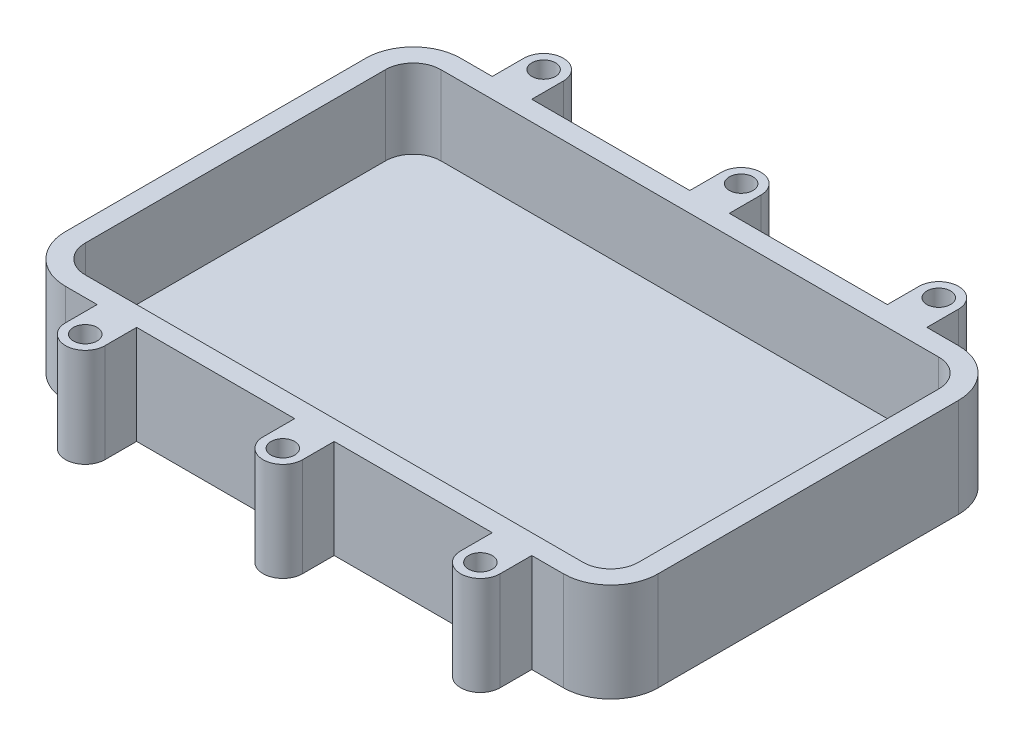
SolidWorks part; units mm, degrees
ref_plane "Front Plane" through (0, 0, 0) normal (0, 0, 1) x (1, 0, 0)
ref_plane "Top Plane" through (0, 0, 0) normal (0, 1, 0) x (1, 0, 0)
ref_plane "Right Plane" through (0, 0, 0) normal (1, 0, 0) x (0, 0, -1)
sketch "Sketch1" plane through (0, 0, 0) normal (0, 1, 0) x (1, 0, 0)
  line L0 (0, 0) -> (-75, 0) construction
  line L1 (63, 50) -> (-63, 50)
  line L2 (63, -50) -> (-63, -50)
  line L3 (-75, 38) -> (-75, -38)
  line L4 (0, 0) -> (0, 50) construction
  line L5 (75, 38) -> (75, -38)
  arc A0 (-75, 38) -> (-63, 50) centre (-63, 38) cw
  arc A1 (63, 50) -> (75, 38) centre (63, 38) cw
  arc A2 (-63, -50) -> (-75, -38) centre (-63, -38) cw
  arc A3 (75, -38) -> (63, -50) centre (63, -38) cw
  point P7 (-75, 0)
  point P10 (0, -50)
  point P12 (-75, 50)
  point P15 (75, 50)
  point P18 (-75, -50)
  point P21 (75, -50)
  dimension "D3" = 12
  dimension "D1" = 100
  dimension "D2" = 150
extrude "Extrude1" add sketch "Sketch1" along normal blind 25
shell "Shell1" thickness 5
sketch "Sketch2" plane through (0, 25, 0) normal (0, 1, 0) x (-1, 0, 0)
  line L0 (0, -50) -> (0, -58) construction
  line L1 (-63, -50) -> (63, -50) construction
  line L2 (-5, -50) -> (-5, -58)
  line L3 (5, -50) -> (5, -58)
  line L4 (5, -50) -> (-5, -50)
  line L5 (45, -50) -> (45, -58)
  line L6 (55, -50) -> (55, -58)
  line L7 (55, -50) -> (45, -50)
  line L8 (50, -50) -> (50, -58) construction
  line L9 (-5, -50) -> (45, -50) construction
  line L10 (75, -38) -> (75, 38) construction
  line L11 (-55, -50) -> (-45, -50)
  line L12 (-55, -50) -> (-55, -58)
  line L13 (-45, -50) -> (-45, -58)
  line L14 (0, -50) -> (0, 0) construction
  arc A0 (45, -58) -> (55, -58) centre (50, -58) ccw
  arc A1 (-5, -58) -> (5, -58) centre (0, -58) ccw
  arc A2 (-45, -58) -> (-55, -58) centre (-50, -58) cw
  dimension "D1" = 8
  dimension "D4" = 25
  dimension "D2" = 5
extrude "Extrude2" add sketch "Sketch2" against normal up to vertex (25 mm away)
hole_wizard "Ø6.0 (6) Diameter Hole1" positions "Sketch4" profile "Sketch3" hole size "Ø6.0" standard "Ansi Metric"
sketch "Sketch4" plane through (0, 25, 0) normal (0, 1, 0) x (-1, 0, 0)
  point P1 (0, -58)
  point P10 (-50, -58)
  point P13 (50, -58)
sketch "Sketch3" plane through (0, 25, -58) normal (1, 0, 0) x (0, 0, 1)
  line L0 (0, 0) -> (0, 25)
  line L1 (0, 25) -> (3, 25)
  line L2 (3, 25) -> (3, 0)
  line L5 (3, 0) -> (0, 0)
  line L11 (0, -6.35) -> (0, 107.95) construction
  dimension "Thru Hole Dia." = 6
  dimension "Thru Hole Depth" = 25
mirror "Mirror1" about plane through (0, 0, 0) normal (0, 0, 1) of "Extrude2", "Ø6.0 (6) Diameter Hole1"
